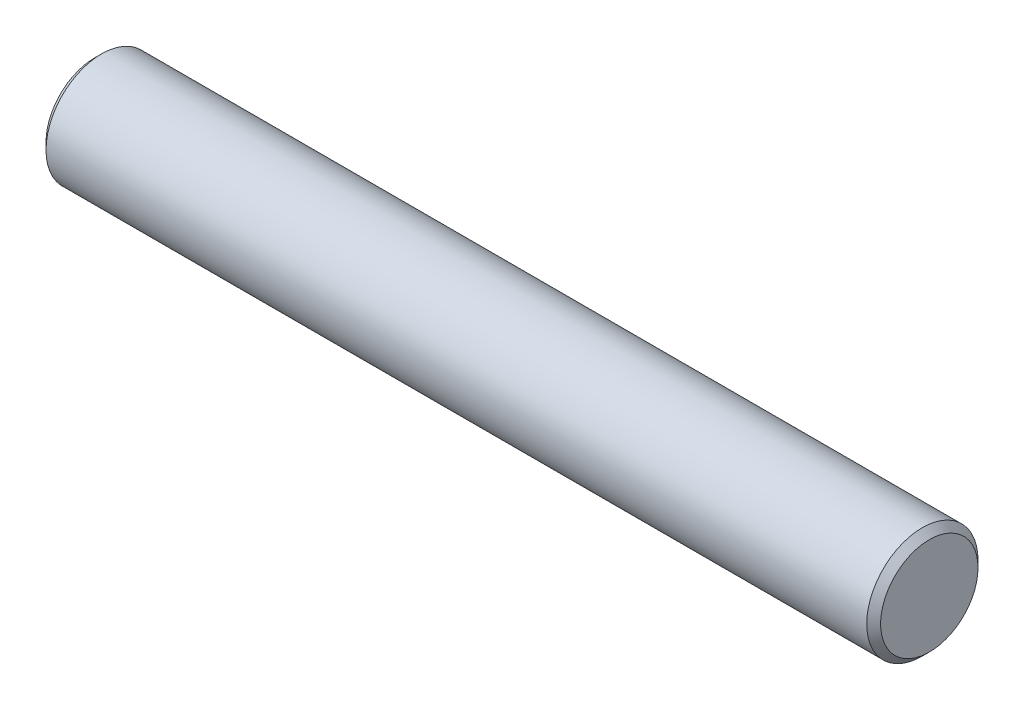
SolidWorks part; units mm, degrees
ref_plane "Plan de face" through (0, 0, 0) normal (0, 0, 1) x (1, 0, 0)
ref_plane "Plan de dessus" through (0, 0, 0) normal (0, 1, 0) x (1, 0, 0)
ref_plane "Plan de droite" through (0, 0, 0) normal (1, 0, 0) x (0, 0, -1)
sketch "Esquisse1" plane through (0, 0, 0) normal (0, 0, 1) x (1, 0, 0)
  line L0 (0, 0) -> (177.9784, 0) construction
  line L1 (0, 0) -> (0, 10)
  line L2 (0, 10) -> (150, 10)
  line L3 (150, 10) -> (150, 0)
  line L4 (150, 0) -> (0, 0)
  line L5 (0, 0) -> (3.1362, 1.9601)
  dimension "D1" = 150
  dimension "D2" = 10
revolve "Révolution1" add sketch "Esquisse1" angle 360 about L0
chamfer "Chanfrein1" distance 1.25 angle 45 2 edges at (0, 0, 10) (150, 0, 10)
ref_plane "Plan1" through (95, 0, 0) normal (1, 0, 0) x (0, 0, -1)
ref_point "Point1"
ref_point "Point2"
